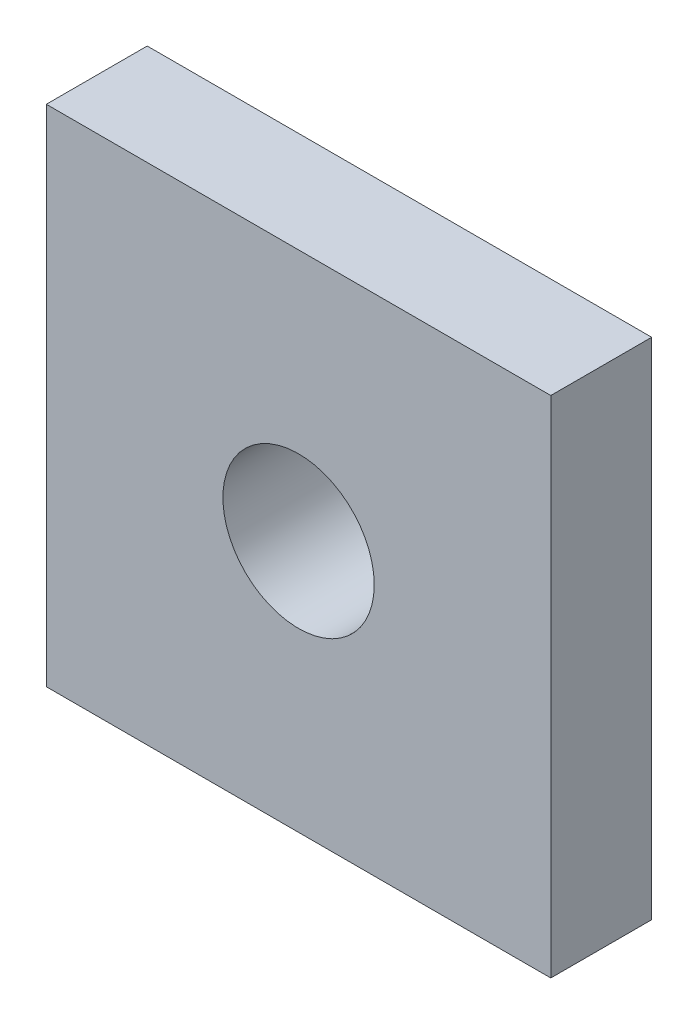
SolidWorks part; units mm, degrees
ref_plane "前视基准面" through (0, 0, 0) normal (0, 0, 1) x (1, 0, 0)
ref_plane "上视基准面" through (0, 0, 0) normal (0, 1, 0) x (1, 0, 0)
ref_plane "右视基准面" through (0, 0, 0) normal (1, 0, 0) x (0, 0, -1)
other "Configuration Table"
sketch "草图1" plane through (0, 0, 0) normal (0, 0, 1) x (1, 0, 0)
  line L1 (-50, -50) -> (50, -50)
  line L2 (-50, -50) -> (-50, 50)
  line L3 (-50, 50) -> (50, 50)
  line L4 (50, -50) -> (50, 50)
  line L5 (-50, -50) -> (50, 50) construction
  line L6 (-50, 50) -> (50, -50) construction
  point P0 (0, 0)
extrude "凸台-拉伸1" add sketch "草图1" against normal blind 20
sketch "草图2" plane through (0, 0, 0) normal (0, 0, 1) x (1, 0, 0)
  circle A0 centre (0, 0) radius 30
extrude "凸台-拉伸2" add sketch "草图2" against normal blind 40
sketch "草图3" plane through (0, 0, 0) normal (0, 0, 1) x (1, 0, 0)
  circle A0 centre (0, 0) radius 15
extrude "切除-拉伸1" cut sketch "草图3" against normal blind 30
